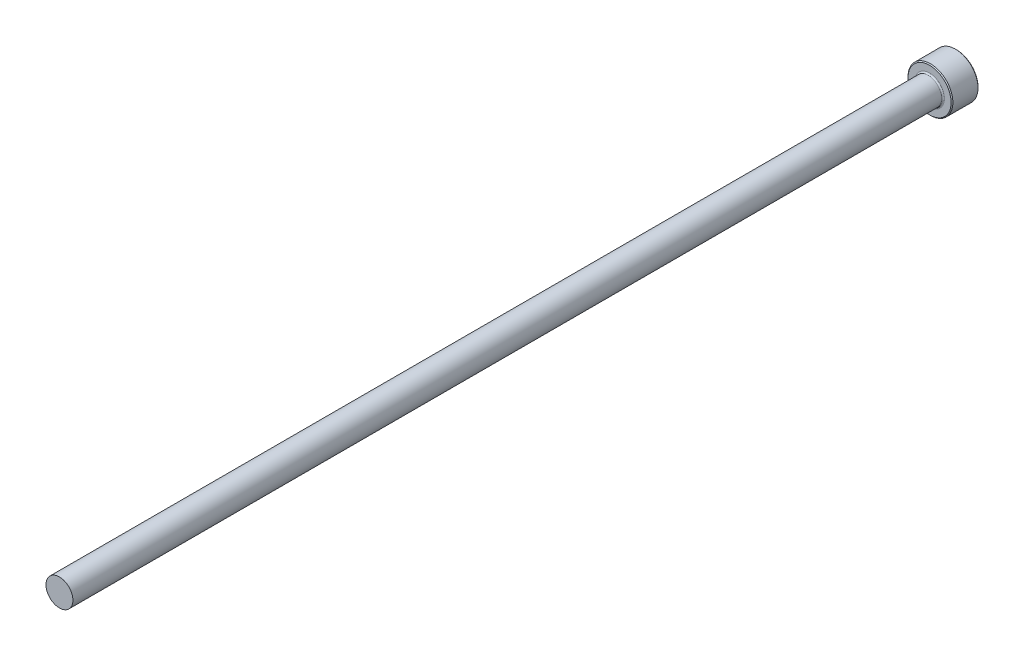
SolidWorks part; units mm, degrees
ref_plane "Front Plane" through (0, 0, 0) normal (0, 0, 1) x (1, 0, 0)
ref_plane "Top Plane" through (0, 0, 0) normal (0, 1, 0) x (1, 0, 0)
ref_plane "Right Plane" through (0, 0, 0) normal (1, 0, 0) x (0, 0, -1)
sketch "Sketch1" plane through (0, 0, 0) normal (1, 0, 0) x (0, 0, -1)
  line L0 (0, 0) -> (0, 5)
  line L1 (0, 5.5) -> (0, -5.5) construction
  line L2 (0, 5) -> (-6, 5)
  line L3 (-6, 5) -> (-6, 3.3)
  line L4 (-6.3, 3) -> (-200, 3)
  line L5 (-200, 3) -> (-200, 0)
  line L6 (5.5, 0) -> (-5.5, 0) construction
  line L7 (-200, 0) -> (0, 0)
  line L8 (-109.0506, 0) -> (16.9928, 0) construction
  arc A0 (-6, 3.3) -> (-6.3, 3) centre (-6.3, 3.3) cw
  dimension "D1" = 0.3
  dimension "D2" = 10
  dimension "D3" = 6
  dimension "D4" = 200
  dimension "D5" = 6
revolve "Revolve1" add sketch "Sketch1" angle 360 about L8
chamfer "Chamfer1" distance 0.2 angle 45 2 edges at (5, 0, 0) (5, 0, 6)
